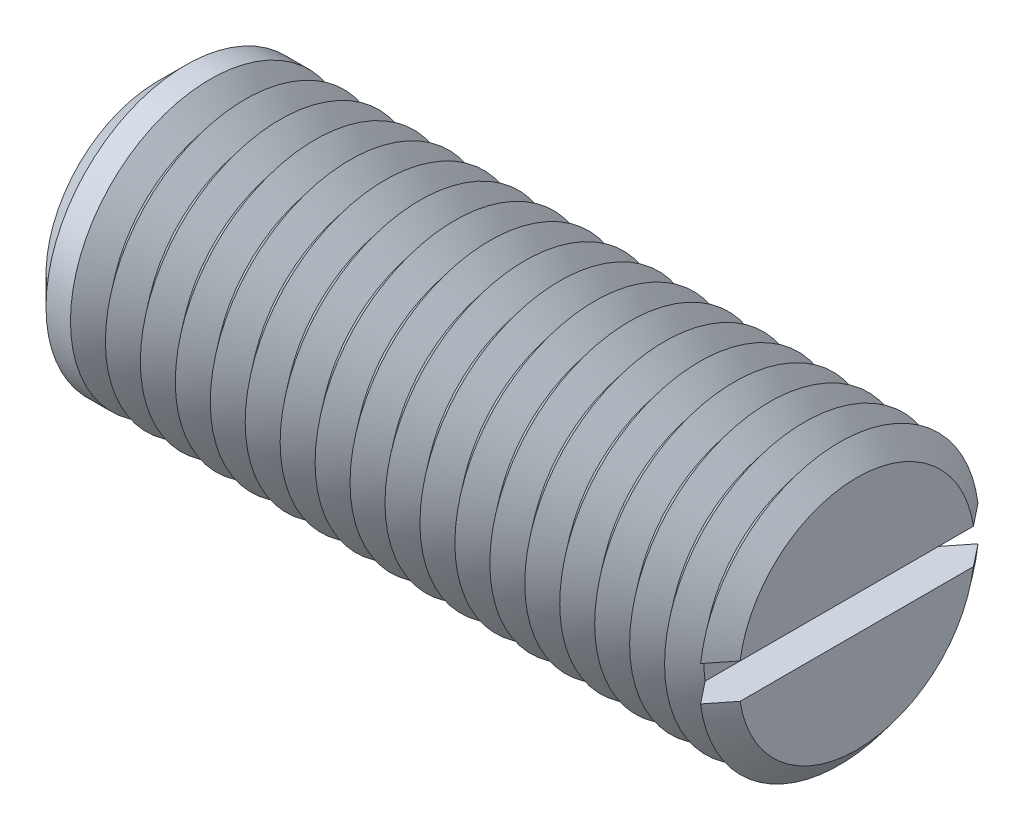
SolidWorks part; units mm, degrees
ref_plane "Front Plane" through (0, 0, 0) normal (0, 0, 1) x (1, 0, 0)
ref_plane "Top Plane" through (0, 0, 0) normal (0, 1, 0) x (1, 0, 0)
ref_plane "Right Plane" through (0, 0, 0) normal (1, 0, 0) x (0, 0, -1)
sketch "Sketch1" plane through (0, 0, 0) normal (1, 0, 0) x (0, 0, -1)
  circle A0 centre (0, 0) radius 8
  dimension "D1" = 16
extrude "Extrude1" add sketch "Sketch1" along normal mid plane 40
sketch "Sketch2" plane through (0, 0, 0) normal (0, 0, 1) x (1, 0, 0)
  line L0 (20, 1) -> (18, 1)
  line L1 (20, -8) -> (20, 8) construction
  line L2 (18, 1) -> (18, -1)
  line L3 (0, 0) -> (50000, 0) construction
  line L4 (20, -1) -> (18, -1)
  line L5 (20, -1) -> (20, 1)
  point P9 (18, 0)
  dimension "D1" = 2
extrude "Extrude2" cut sketch "Sketch2" against normal mid plane 24
chamfer "Chamfer1" distance 1.6 angle 45 1 edges at (-20, 0, -8)
sketch "Sketch3" plane through (0, 0, 0) normal (0, 0, 1) x (1, 0, 0)
  line L0 (0, 0) -> (30.9602, 0) construction
  line L1 (19, -8) -> (21, -8)
  line L2 (-18.4, -8) -> (20, -8) construction
  line L3 (21, -8) -> (20, -6.751)
  line L4 (20, -8) -> (20, -1) construction
  line L5 (20, -6.751) -> (19, -8)
  dimension "D1" = 2
  dimension "D2" = 1.6
revolve "Cut-Revolve1" cut sketch "Sketch3" angle 360 about L0
pattern_linear "LPattern1" count 19 spacing 2 along (-1, 0, 0) of "Cut-Revolve1"
equation "\"D2@Sketch3\" = \"D1@Sketch3\"*0.8"
